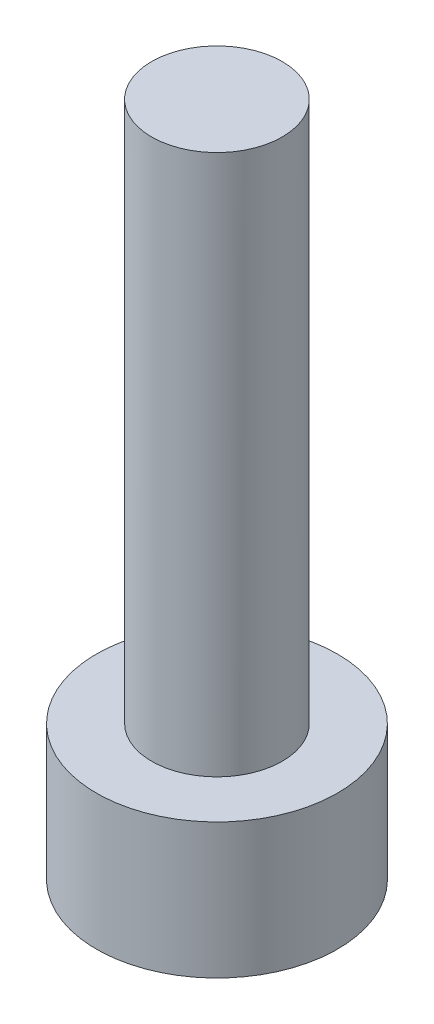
SolidWorks part; units mm, degrees
ref_plane "Front Plane" through (0, 0, 0) normal (0, 0, 1) x (1, 0, 0)
ref_plane "Top Plane" through (0, 0, 0) normal (0, 1, 0) x (1, 0, 0)
ref_plane "Right Plane" through (0, 0, 0) normal (1, 0, 0) x (0, 0, -1)
sketch "Sketch1" plane through (0, 0, 0) normal (0, 1, 0) x (1, 0, 0)
  circle A0 centre (0, 0) radius 1.45
extrude "Boss-Extrude1" add sketch "Sketch1" along normal blind 12
sketch "Sketch2" plane through (0, 0, 0) normal (0, -1, 0) x (1, 0, 0)
  circle A0 centre (0, 0) radius 2.675
extrude "Boss-Extrude2" add sketch "Sketch2" along normal blind 3
sketch "Sketch3" plane through (0, -3, 0) normal (0, -1, 0) x (1, 0, 0)
  line L1 (1.6619, 0.4878) -> (0.4085, 1.6832)
  line L2 (0.4085, 1.6832) -> (-1.2534, 1.1954)
  line L3 (-1.2534, 1.1954) -> (-1.6619, -0.4878)
  line L4 (-1.6619, -0.4878) -> (-0.4085, -1.6832)
  line L5 (-0.4085, -1.6832) -> (1.2534, -1.1954)
  line L6 (1.2534, -1.1954) -> (1.6619, 0.4878)
  circle A0 centre (0, 0) radius 1.5 construction
extrude "Cut-Extrude1" cut sketch "Sketch3" against normal blind 2
